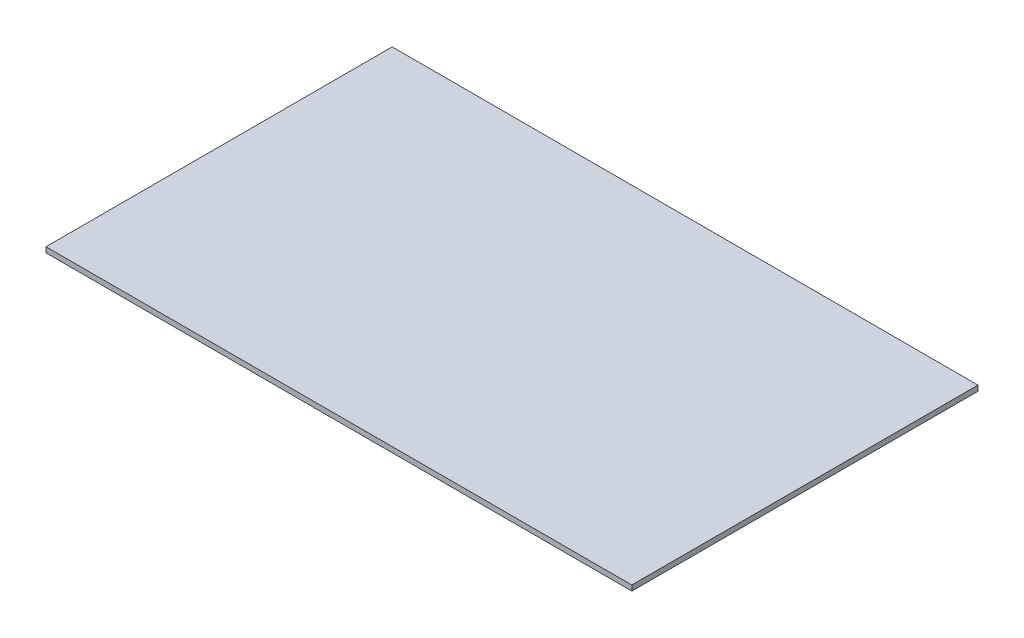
SolidWorks part; units mm, degrees
ref_plane "Front Plane" through (0, 0, 0) normal (0, 0, 1) x (1, 0, 0)
ref_plane "Top Plane" through (0, 0, 0) normal (0, 1, 0) x (1, 0, 0)
ref_plane "Right Plane" through (0, 0, 0) normal (1, 0, 0) x (0, 0, -1)
sketch "Sketch1" plane through (0, 0, 0) normal (0, 1, 0) x (1, 0, 0)
  line L0 (0, 0) -> (-110, 0) construction
  line L1 (-110, 65) -> (110, 65)
  line L2 (-110, 65) -> (-110, -65)
  line L3 (-110, -65) -> (110, -65)
  line L4 (110, 65) -> (110, -65)
  line L5 (-110, 65) -> (110, -65) construction
  line L6 (-110, -65) -> (110, 65) construction
  line L7 (0, 0) -> (110, 0) construction
  line L8 (110, -25) -> (-110, -25) construction
  line L9 (-110, -30) -> (110, -30) construction
  point P0 (0, 0)
  dimension "D1" = 130
  dimension "D2" = 220
  dimension "D3" = 40
  dimension "D4" = 5
extrude "Boss-Extrude1" add sketch "Sketch1" along normal blind 2
